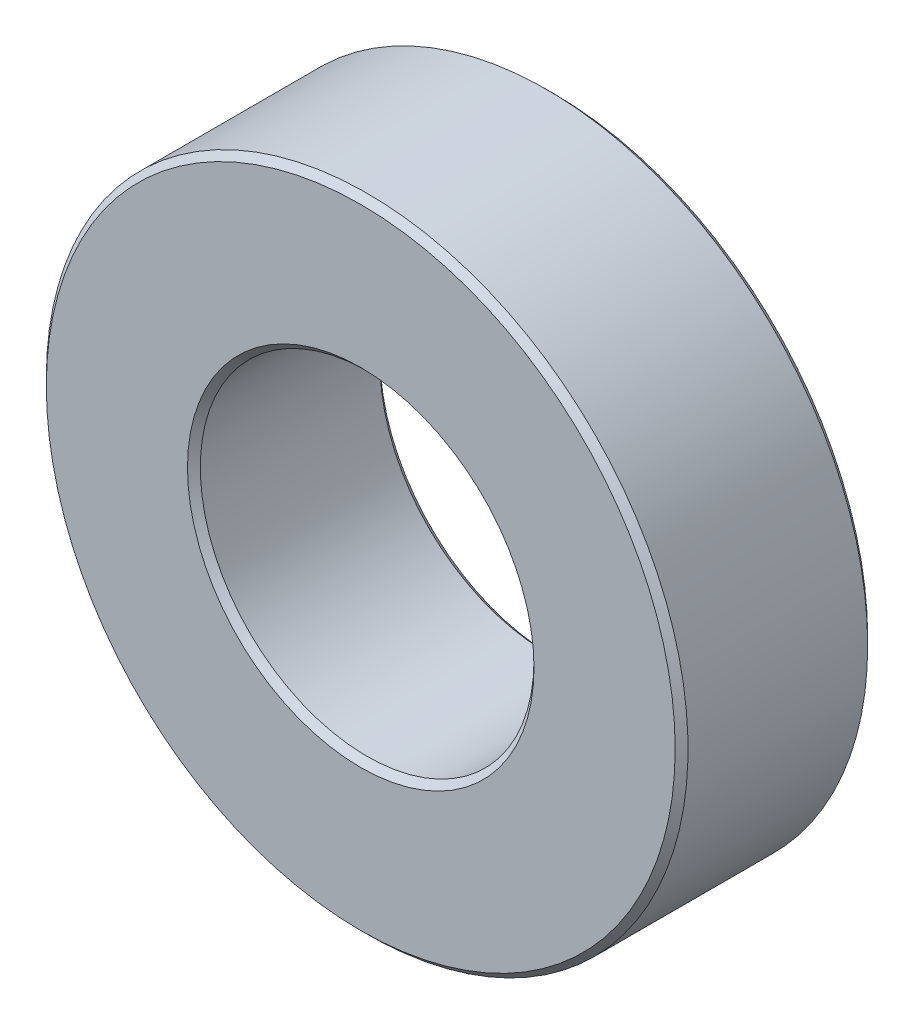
SolidWorks part; units mm, degrees
ref_plane "Front Plane" through (0, 0, 0) normal (0, 0, 1) x (1, 0, 0)
ref_plane "Top Plane" through (0, 0, 0) normal (0, 1, 0) x (1, 0, 0)
ref_plane "Right Plane" through (0, 0, 0) normal (1, 0, 0) x (0, 0, -1)
sketch "Sketch1" plane through (0, 0, 0) normal (0, 0, 1) x (1, 0, 0)
  circle A0 centre (0, 0) radius 5
  circle A1 centre (0, 0) radius 2.6
  dimension "D1" = 10
  dimension "D2" = 5.2
extrude "Boss-Extrude2" add sketch "Sketch1" along normal mid plane 3
chamfer "Chamfer3" distance 0.1 angle 45 4 edges at (5, 0, 1.5) (5, 0, -1.5) (2.6, 0, -1.5) (2.6, 0, 1.5)
